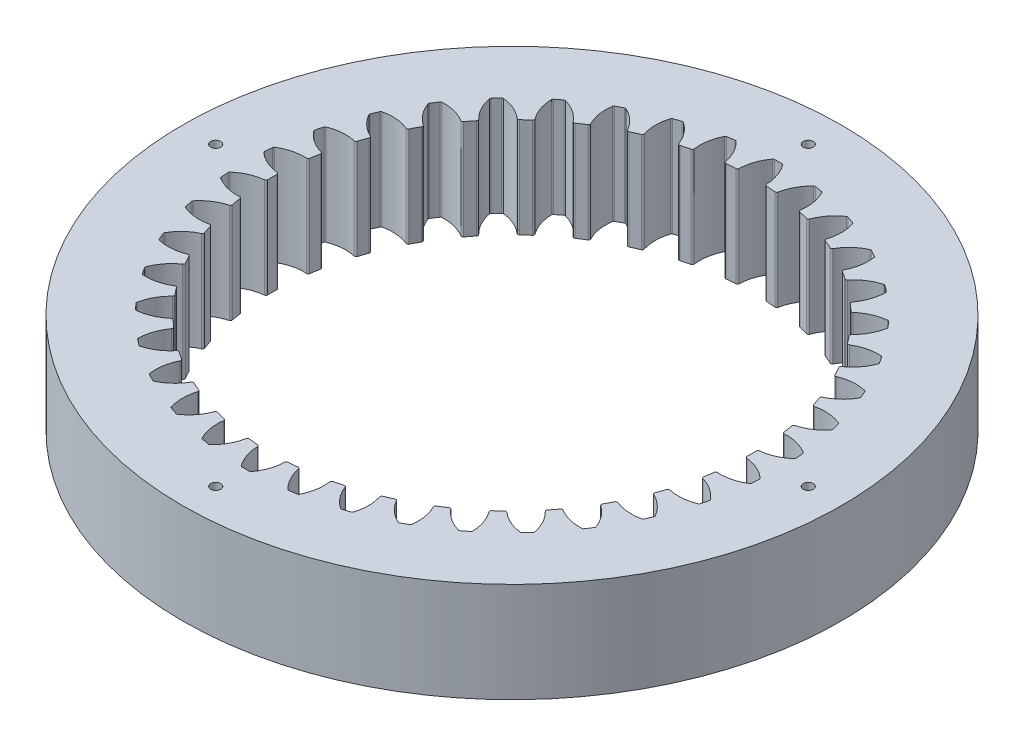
SolidWorks part; units mm, degrees
ref_plane "Front Plane" through (0, 0, 0) normal (0, 0, 1) x (1, 0, 0)
ref_plane "Top Plane" through (0, 0, 0) normal (0, 1, 0) x (1, 0, 0)
ref_plane "Right Plane" through (0, 0, 0) normal (1, 0, 0) x (0, 0, -1)
sketch "Sketch1"
  dimension "D1" = 198
  dimension "D3" = 3
  dimension "D4" = 3
  dimension "D5" = 10
  dimension "D6" = 3
  dimension "D8" = 3
  dimension "D10" = 178
  dimension "D2" = 10
  dimension "D7" = 10
  dimension "D9" = 10
extrude "Boss-Extrude1" add sketch "Sketch1" along normal blind 30
